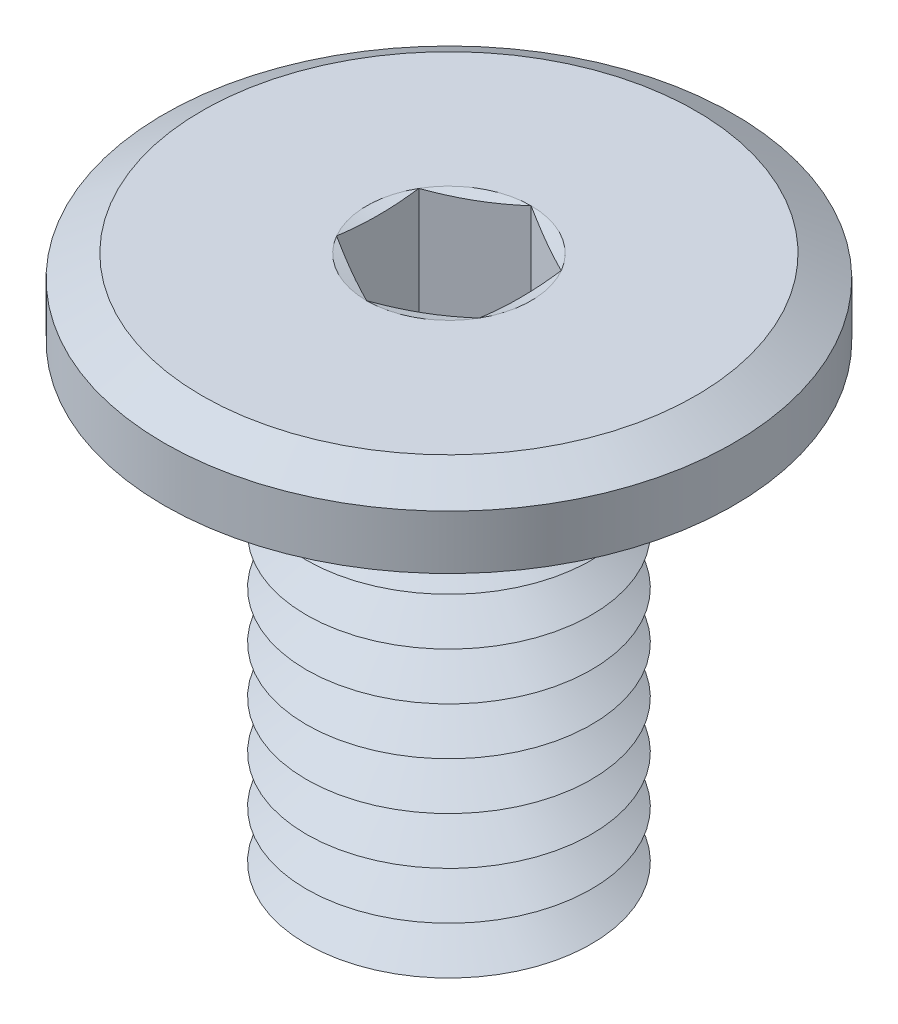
SolidWorks part; units mm, degrees
ref_plane "Front Plane" through (0, 0, 0) normal (0, 0, 1) x (1, 0, 0)
ref_plane "Top Plane" through (0, 0, 0) normal (0, 1, 0) x (1, 0, 0)
ref_plane "Right Plane" through (0, 0, 0) normal (1, 0, 0) x (0, 0, -1)
sketch "Sketch1" plane through (0, 0, 0) normal (0, 1, 0) x (1, 0, 0)
  circle A0 centre (0, 0) radius 3
  dimension "D1" = 6
extrude "Boss-Extrude1" add sketch "Sketch1" against normal blind 0.8
sketch "Sketch2" plane through (0, -0.8, 0) normal (0, -1, 0) x (1, 0, 0)
  circle A0 centre (0, 0) radius 1.5
  dimension "D1" = 3
extrude "Boss-Extrude2" add sketch "Sketch2" along normal blind 5
sketch "Sketch3" plane through (0, 0, 0) normal (1, 0, 0) x (0, 0, -1)
  line L0 (0, 0.9906) -> (0, -8.2999) construction
sketch "Sketch5" plane through (0, 0, 0) normal (1, 0, 0) x (0, 0, -1)
  line L0 (-1.5, -6.05) -> (-1.067, -5.8)
  line L1 (-1.5, -0.8) -> (-1.5, -5.8) construction
  line L2 (-1.067, -5.8) -> (-1.5, -5.55)
  line L3 (-1.5, -0.8) -> (-1.5, -5.8) construction
  line L4 (-1.5, -5.55) -> (-1.5, -6.05)
  line L6 (-1.5, -0.8) -> (-1.5, -5.8) construction
  line L7 (-1.5, -0.8) -> (-1.5, -5.8) construction
  line L14 (-1.5, -5.8) -> (1.5, -5.8) construction
  dimension "D1" = 0.5
revolve "Cut-Revolve1" cut sketch "Sketch5" angle 360 about L0
pattern_linear "LPattern1" count 9 spacing 0.5 along (0, 1, 0) of "Cut-Revolve1"
fillet "Fillet1" radius 0.1 1 edges at (0, -0.8, -1.5)
chamfer "Chamfer2" distance 0.4 angle 30 1 edges at (0, 0, 3)
sketch "Sketch6" plane through (0, 0, 0) normal (0, 1, 0) x (1, 0, 0)
  line L1 (0, 0.866) -> (-0.75, 0.433)
  line L2 (-0.75, 0.433) -> (-0.75, -0.433)
  line L3 (-0.75, -0.433) -> (0, -0.866)
  line L4 (0, -0.866) -> (0.75, -0.433)
  line L5 (0.75, -0.433) -> (0.75, 0.433)
  line L6 (0.75, 0.433) -> (0, 0.866)
  circle A0 centre (0, 0) radius 0.75 construction
  dimension "D1" = 1.5
extrude "Cut-Extrude1" cut sketch "Sketch6" against normal blind 1.4
sketch "Sketch7" plane through (0, -1.4, 0) normal (0, 1, 0) x (1, 0, 0)
  line L0 (-0.75, 0.433) -> (-0.75, -0.433) construction
  circle A0 centre (0, 0) radius 0.75
extrude "Cut-Extrude2" cut sketch "Sketch7" against normal through all draft 60
sketch "Sketch8" plane through (0, 0, 0) normal (0, 1, 0) x (1, 0, 0)
  circle A0 centre (0, 0) radius 0.866
extrude "Cut-Extrude3" cut sketch "Sketch8" against normal through all draft 75
